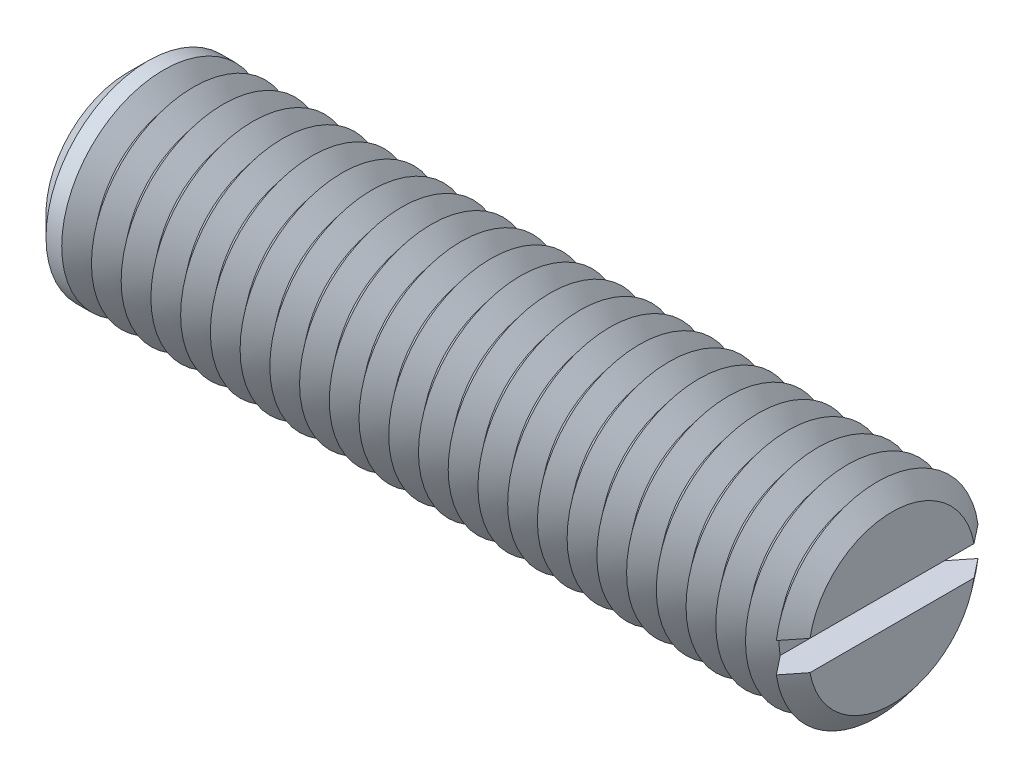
SolidWorks part; units mm, degrees
ref_plane "Front Plane" through (0, 0, 0) normal (0, 0, 1) x (1, 0, 0)
ref_plane "Top Plane" through (0, 0, 0) normal (0, 1, 0) x (1, 0, 0)
ref_plane "Right Plane" through (0, 0, 0) normal (1, 0, 0) x (0, 0, -1)
sketch "Sketch1" plane through (0, 0, 0) normal (1, 0, 0) x (0, 0, -1)
  circle A0 centre (0, 0) radius 6
  dimension "D1" = 12
extrude "Extrude1" add sketch "Sketch1" along normal mid plane 45
sketch "Sketch2" plane through (0, 0, 0) normal (0, 0, 1) x (1, 0, 0)
  line L0 (22.5, 0.875) -> (20.75, 0.875)
  line L1 (22.5, -6) -> (22.5, 6) construction
  line L2 (20.75, 0.875) -> (20.75, -0.875)
  line L3 (0, 0) -> (50000, 0) construction
  line L4 (22.5, -0.875) -> (20.75, -0.875)
  line L5 (22.5, -0.875) -> (22.5, 0.875)
  point P9 (20.75, 0)
  dimension "D1" = 1.75
extrude "Extrude2" cut sketch "Sketch2" against normal mid plane 18
chamfer "Chamfer1" distance 1.2 angle 45 1 edges at (-22.5, 0, -6)
sketch "Sketch3" plane through (0, 0, 0) normal (0, 0, 1) x (1, 0, 0)
  line L0 (0, 0) -> (30.9602, 0) construction
  line L1 (21.625, -6) -> (23.375, -6)
  line L2 (-21.3, -6) -> (22.5, -6) construction
  line L3 (23.375, -6) -> (22.5, -4.9071)
  line L4 (22.5, -6) -> (22.5, -0.875) construction
  line L5 (22.5, -4.9071) -> (21.625, -6)
  dimension "D1" = 1.75
  dimension "D2" = 1.4
revolve "Cut-Revolve1" cut sketch "Sketch3" angle 360 about L0
pattern_linear "LPattern1" count 25 spacing 1.75 along (-1, 0, 0) of "Cut-Revolve1"
equation "\"D2@Sketch3\" = \"D1@Sketch3\"*0.8"
